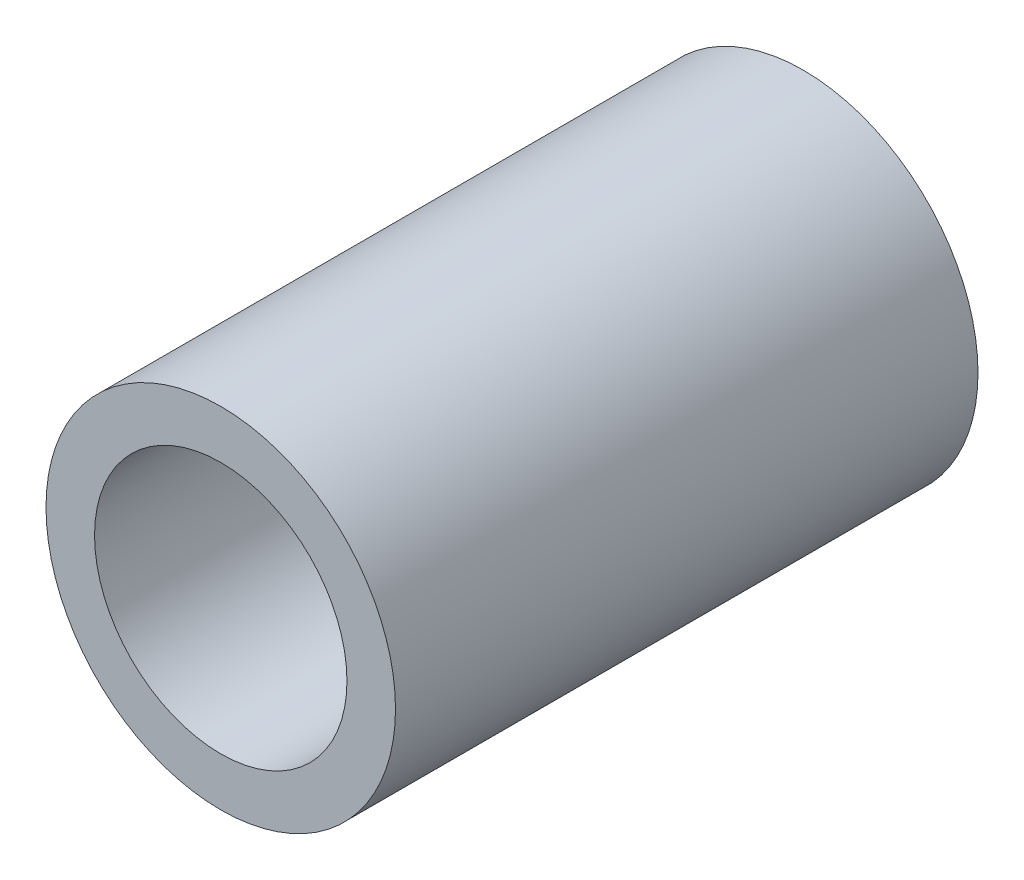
SolidWorks part; units mm, degrees
ref_plane "前视基准面" through (0, 0, 0) normal (0, 0, 1) x (1, 0, 0)
ref_plane "上视基准面" through (0, 0, 0) normal (0, 1, 0) x (1, 0, 0)
ref_plane "右视基准面" through (0, 0, 0) normal (1, 0, 0) x (0, 0, -1)
sketch "草图1" plane through (0, 0, 0) normal (0, 0, 1) x (1, 0, 0)
  circle A0 centre (0, 0) radius 9
  circle A1 centre (0, 0) radius 6.5
extrude "凸台-拉伸1" add sketch "草图1" along normal blind 30
